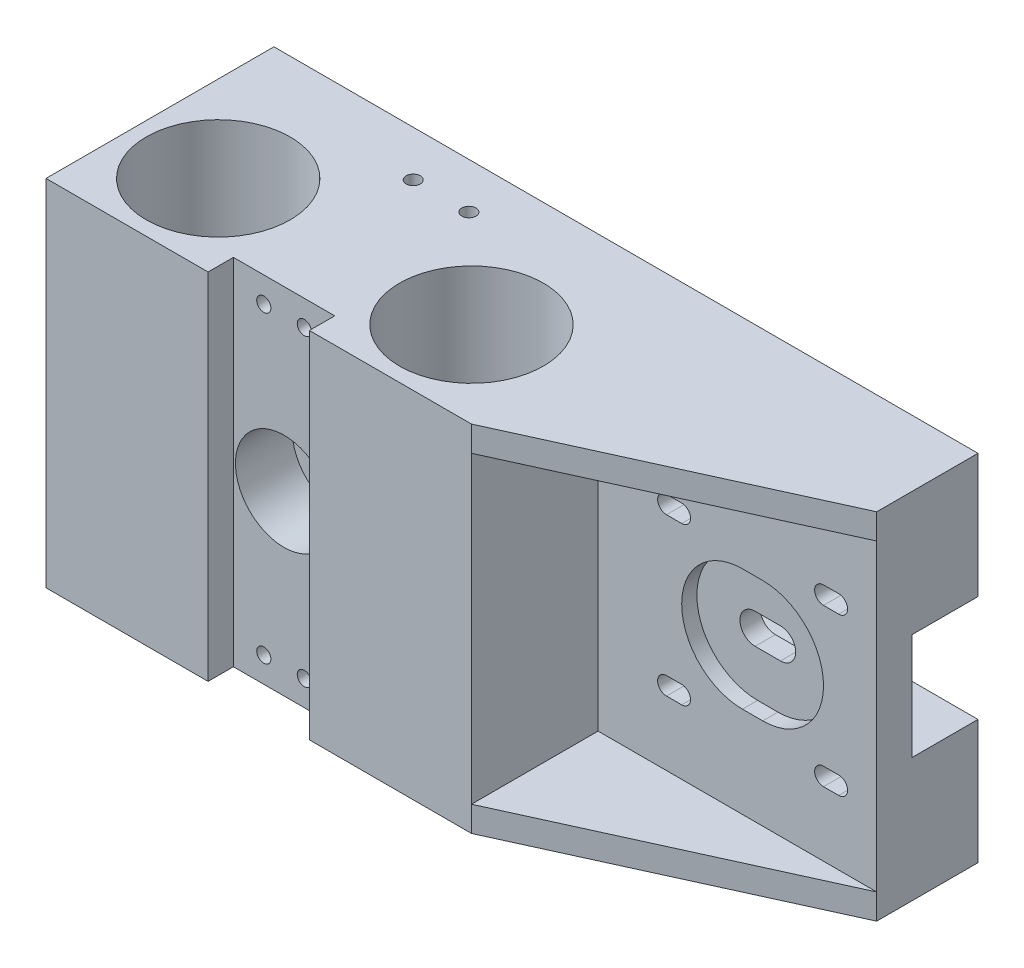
SolidWorks part; units mm, degrees
ref_plane "Спереди" through (0, 0, 0) normal (0, 0, 1) x (1, 0, 0)
ref_plane "Сверху" through (0, 0, 0) normal (0, 1, 0) x (1, 0, 0)
ref_plane "Справа" through (0, 0, 0) normal (1, 0, 0) x (0, 0, -1)
sketch "Эскиз1" plane through (0, 0, 0) normal (0, 1, 0) x (1, 0, 0)
  line L0 (0, 0) -> (0, 80) construction
  line L1 (-36.9154, 0) -> (36.9154, 0) construction
  line L2 (10, 0) -> (10, -5)
  line L3 (10, -5) -> (42, -5)
  line L4 (42, -5) -> (42, 40)
  line L5 (42, 40) -> (0, 40)
  line L6 (10, 0) -> (-10, 0)
  line L7 (-42, -5) -> (-42, 40)
  line L8 (-42, 40) -> (0, 40)
  line L9 (-10, -5) -> (-42, -5)
  line L10 (-10, 0) -> (-10, -5)
  circle A0 centre (-25, 12) radius 14.2
  circle A1 centre (25, 12) radius 14.2
  dimension "D1" = 50
  dimension "D2" = 28.4
  dimension "D3" = 5
  dimension "D4" = 40
  dimension "D5" = 20
  dimension "D6" = 17
  dimension "D7" = 42
extrude "Бобышка-Вытянуть1" add sketch "Эскиз1" along normal blind 70
sketch "Эскиз2" plane through (0, 0, 0) normal (0, 0, 1) x (1, 0, 0)
  line L0 (0, 0) -> (0, 70) construction
  line L1 (10, 70) -> (-10, 70) construction
  line L2 (-10, 35) -> (0, 35) construction
  line L4 (-10, 70) -> (-10, 0) construction
  circle A0 centre (-4, 65) radius 1.4
  circle A1 centre (-4, 5) radius 1.4
  circle A2 centre (4, 5) radius 1.4
  circle A3 centre (4, 65) radius 1.4
  dimension "D1" = 5
  dimension "D2" = 4
  dimension "D3" = 2.8
extrude "Вырез-Вытянуть1" cut sketch "Эскиз2" against normal blind 5
sketch "Эскиз3" plane through (0, 0, 0) normal (0, 0, 1) x (1, 0, 0)
  line L0 (-10, 35) -> (10, 35) construction
  line L1 (-10, 70) -> (-10, 0) construction
  line L2 (10, 70) -> (10, 0) construction
  circle A0 centre (0, 35) radius 9.6
  dimension "D1" = 19.2
extrude "Вырез-Вытянуть2" cut sketch "Эскиз3" against normal blind 11.2
sketch "Эскиз4" plane through (0, 0, -40) normal (0, 0, -1) x (-1, 0, 0)
  line L0 (-42, 35) -> (42, 35) construction
  line L1 (-42, 70) -> (-42, 0) construction
  line L2 (42, 70) -> (42, 0) construction
  circle A0 centre (0, 35) radius 9.6
  dimension "D1" = 19.2
extrude "Вырез-Вытянуть3" cut sketch "Эскиз4" against normal blind 19
sketch "Эскиз5" plane through (42, 0, 0) normal (1, 0, 0) x (0, 0, -1)
  line L0 (-5, 35) -> (40, 35) construction
  line L1 (40, 70) -> (20, 70)
  line L2 (40, 70) -> (40, 0)
  line L3 (40, 0) -> (20, 0)
  line L4 (20, 70) -> (20, 0)
  line L5 (-5, 70) -> (-5, 0) construction
  line L6 (40, 70) -> (40, 0) construction
  line L7 (-5, 70) -> (40, 70) construction
  dimension "D2" = 20
extrude "Бобышка-Вытянуть2" add sketch "Эскиз5" along normal blind 55
sketch "Эскиз6" plane through (0, 0, -40) normal (0, 0, -1) x (-1, 0, 0)
  line L0 (0, 35) -> (-97, 35) construction
  line L1 (-97, 0) -> (-97, 70) construction
  line L2 (-97, 0) -> (-97, 70) construction
  line L3 (-97, 45.5) -> (10, 45.5)
  line L4 (-97, 45.5) -> (-97, 24.5)
  line L5 (-97, 24.5) -> (10, 24.5)
  line L6 (10, 45.5) -> (10, 24.5)
  circle A0 centre (0, 35) radius 9.6 construction
  dimension "D2" = 10
  dimension "D1" = 21
  dimension "D3" = 0
extrude "Вырез-Вытянуть4" cut sketch "Эскиз6" against normal blind 13
sketch "Эскиз7" plane through (0, 70, 0) normal (0, 1, 0) x (1, 0, 0)
  line L0 (42, -5) -> (97, 20)
  line L1 (97, 20) -> (42, 20)
  line L2 (42, 20) -> (42, -5)
extrude "Бобышка-Вытянуть3" add sketch "Эскиз7" against normal blind 5
sketch "Эскиз8" plane through (0, 0, 0) normal (0, -1, 0) x (1, 0, 0)
  line L0 (42, 5) -> (97, -20)
  line L1 (97, -20) -> (42, -20)
  line L2 (42, -20) -> (42, 5)
extrude "Бобышка-Вытянуть4" add sketch "Эскиз8" against normal blind 5
sketch "Эскиз9" plane through (0, 0, -40) normal (0, 0, -1) x (-1, 0, 0)
  line L0 (-89.5, 50.5) -> (-86.5, 50.5) construction
  line L1 (-89.5, 52.25) -> (-86.5, 52.25)
  line L2 (-89.5, 48.75) -> (-86.5, 48.75)
  line L3 (-58.5, 50.5) -> (-55.5, 50.5) construction
  line L4 (-58.5, 52.25) -> (-55.5, 52.25)
  line L5 (-58.5, 48.75) -> (-55.5, 48.75)
  line L6 (-89.5, 19.5) -> (-86.5, 19.5) construction
  line L7 (-89.5, 21.25) -> (-86.5, 21.25)
  line L8 (-89.5, 17.75) -> (-86.5, 17.75)
  line L9 (-58.5, 19.5) -> (-55.5, 19.5) construction
  line L10 (-58.5, 21.25) -> (-55.5, 21.25)
  line L11 (-58.5, 17.75) -> (-55.5, 17.75)
  arc A0 (-58.5, 21.25) -> (-58.5, 17.75) centre (-58.5, 19.5) ccw
  circle A1 centre (-57, 19.5) radius 2 construction
  circle A2 centre (-88, 19.5) radius 2 construction
  circle A3 centre (-88, 50.5) radius 2 construction
  circle A4 centre (-57, 50.5) radius 2 construction
  circle A6 centre (-57, 19.5) radius 2 construction
  circle A7 centre (-88, 19.5) radius 2 construction
  circle A8 centre (-88, 50.5) radius 2 construction
  circle A9 centre (-57, 50.5) radius 2 construction
  arc A14 (-89.5, 52.25) -> (-89.5, 48.75) centre (-89.5, 50.5) ccw
  arc A15 (-86.5, 48.75) -> (-86.5, 52.25) centre (-86.5, 50.5) ccw
  arc A16 (-58.5, 52.25) -> (-58.5, 48.75) centre (-58.5, 50.5) ccw
  arc A17 (-55.5, 48.75) -> (-55.5, 52.25) centre (-55.5, 50.5) ccw
  arc A18 (-89.5, 21.25) -> (-89.5, 17.75) centre (-89.5, 19.5) ccw
  arc A19 (-86.5, 17.75) -> (-86.5, 21.25) centre (-86.5, 19.5) ccw
  arc A20 (-55.5, 17.75) -> (-55.5, 21.25) centre (-55.5, 19.5) ccw
  point P10 (-88, 50.5)
  point P19 (-57, 50.5)
  point P26 (-88, 19.5)
  point P33 (-57, 19.5)
  dimension "D1" = 3.5
  dimension "D2" = 3
  dimension "D3" = 3.5
  dimension "D4" = 3
  dimension "D5" = 3.5
  dimension "D6" = 3
  dimension "D7" = 3
  dimension "D8" = 3.5
extrude "Вырез-Вытянуть5" cut sketch "Эскиз9" against normal blind 68
sketch "Эскиз10" plane through (0, 0, -21) normal (0, 0, -1) x (-1, 0, 0)
  circle A0 centre (0, 35) radius 3.25
  dimension "D1" = 6.5
extrude "Вырез-Вытянуть6" cut sketch "Эскиз10" against normal blind 68
sketch "Эскиз11" plane through (0, 0, -20) normal (0, 0, 1) x (1, 0, 0)
  line L0 (70.5, 35) -> (74.5, 35) construction
  line L1 (70.5, 47) -> (74.5, 47)
  line L2 (70.5, 23) -> (74.5, 23)
  circle A0 centre (72.5, 35) radius 11 construction
  circle A1 centre (72.5, 35) radius 11 construction
  arc A3 (70.5, 47) -> (70.5, 23) centre (70.5, 35) ccw
  arc A4 (74.5, 23) -> (74.5, 47) centre (74.5, 35) ccw
  point P5 (72.5, 35)
  dimension "D1" = 24
  dimension "D2" = 4
extrude "Вырез-Вытянуть7" cut sketch "Эскиз11" against normal blind 3
sketch "Эскиз12" plane through (0, 0, -23) normal (0, 0, 1) x (1, 0, 0)
  line L0 (72.5, 47) -> (72.5, 23) construction
  line L1 (74.5, 47) -> (70.5, 47) construction
  line L2 (70.5, 23) -> (74.5, 23) construction
  line L3 (70, 35) -> (75, 35) construction
  line L4 (70, 38) -> (75, 38)
  line L5 (70, 32) -> (75, 32)
  arc A1 (70, 38) -> (70, 32) centre (70, 35) ccw
  arc A2 (75, 32) -> (75, 38) centre (75, 35) ccw
  point P9 (72.5, 35)
  dimension "D1" = 6
  dimension "D2" = 5
extrude "Вырез-Вытянуть8" cut sketch "Эскиз12" against normal through all
sketch "Эскиз14" plane through (0, 0, -40) normal (0, 0, -1) x (-1, 0, 0)
  line L0 (-91.25, 50.5) -> (-84.75, 50.5) construction
  line L1 (-88, 52.25) -> (-88, 48.75) construction
  line L2 (-86.5, 52.25) -> (-89.5, 52.25) construction
  line L3 (-89.5, 48.75) -> (-86.5, 48.75) construction
  line L4 (-60.25, 50.5) -> (-53.75, 50.5) construction
  line L5 (-57, 52.25) -> (-57, 48.75) construction
  line L6 (-55.5, 52.25) -> (-58.5, 52.25) construction
  line L7 (-58.5, 48.75) -> (-55.5, 48.75) construction
  line L8 (-88, 21.25) -> (-88, 17.75) construction
  line L9 (-86.5, 21.25) -> (-89.5, 21.25) construction
  line L10 (-89.5, 17.75) -> (-86.5, 17.75) construction
  line L11 (-91.25, 19.5) -> (-84.75, 19.5) construction
  line L12 (-57, 21.25) -> (-57, 17.75) construction
  line L13 (-55.5, 21.25) -> (-58.5, 21.25) construction
  line L14 (-58.5, 17.75) -> (-55.5, 17.75) construction
  line L15 (-60.25, 19.5) -> (-53.75, 19.5) construction
  line L16 (-90, 50.5) -> (-86, 50.5) construction
  line L17 (-90, 53.5) -> (-86, 53.5)
  line L18 (-90, 47.5) -> (-86, 47.5)
  line L19 (-59, 50.5) -> (-55, 50.5) construction
  line L20 (-59, 53.5) -> (-55, 53.5)
  line L21 (-59, 47.5) -> (-55, 47.5)
  line L22 (-90, 19.5) -> (-86, 19.5) construction
  line L23 (-90, 22.5) -> (-86, 22.5)
  line L24 (-90, 16.5) -> (-86, 16.5)
  line L25 (-59, 19.5) -> (-55, 19.5) construction
  line L26 (-59, 22.5) -> (-55, 22.5)
  line L27 (-59, 16.5) -> (-55, 16.5)
  arc A0 (-89.5, 52.25) -> (-89.5, 48.75) centre (-89.5, 50.5) ccw construction
  arc A1 (-86.5, 48.75) -> (-86.5, 52.25) centre (-86.5, 50.5) ccw construction
  arc A2 (-58.5, 52.25) -> (-58.5, 48.75) centre (-58.5, 50.5) ccw construction
  arc A3 (-55.5, 48.75) -> (-55.5, 52.25) centre (-55.5, 50.5) ccw construction
  arc A4 (-89.5, 21.25) -> (-89.5, 17.75) centre (-89.5, 19.5) ccw construction
  arc A5 (-86.5, 17.75) -> (-86.5, 21.25) centre (-86.5, 19.5) ccw construction
  arc A6 (-58.5, 21.25) -> (-58.5, 17.75) centre (-58.5, 19.5) ccw construction
  arc A7 (-55.5, 17.75) -> (-55.5, 21.25) centre (-55.5, 19.5) ccw construction
  arc A8 (-90, 53.5) -> (-90, 47.5) centre (-90, 50.5) ccw
  arc A9 (-86, 47.5) -> (-86, 53.5) centre (-86, 50.5) ccw
  arc A10 (-59, 53.5) -> (-59, 47.5) centre (-59, 50.5) ccw
  arc A11 (-55, 47.5) -> (-55, 53.5) centre (-55, 50.5) ccw
  arc A12 (-90, 22.5) -> (-90, 16.5) centre (-90, 19.5) ccw
  arc A13 (-86, 16.5) -> (-86, 22.5) centre (-86, 19.5) ccw
  arc A14 (-59, 22.5) -> (-59, 16.5) centre (-59, 19.5) ccw
  arc A15 (-55, 16.5) -> (-55, 22.5) centre (-55, 19.5) ccw
  point P58 (-88, 50.5)
  point P63 (-57, 50.5)
  point P72 (-88, 19.5)
  point P77 (-57, 19.5)
  dimension "D1" = 6
  dimension "D2" = 6
  dimension "D3" = 6
  dimension "D4" = 6
  dimension "D5" = 4
  dimension "D6" = 4
  dimension "D7" = 4
  dimension "D8" = 4
extrude "Вырез-Вытянуть10" cut sketch "Эскиз14" against normal blind 5
sketch "Эскиз15" plane through (0, 0, -40) normal (0, 0, -1) x (-1, 0, 0)
  line L0 (42, 35) -> (-97, 35) construction
  line L1 (42, 70) -> (42, 0) construction
  line L2 (-97, 45.5) -> (-97, 24.5) construction
  line L3 (-97, 70) -> (42, 70) construction
  line L4 (-92, 65) -> (37, 65) construction
  line L5 (-92, 65) -> (-92, 5) construction
  line L6 (-92, 5) -> (37, 5) construction
  line L7 (37, 65) -> (37, 5) construction
  line L8 (-97, 45.5) -> (-97, 70) construction
  circle A0 centre (-92, 65) radius 1.4
  circle A1 centre (37, 65) radius 1.4
  circle A2 centre (37, 5) radius 1.4
  circle A3 centre (-92, 5) radius 1.4
  circle A4 centre (-27.5, 65) radius 1.4
  circle A6 centre (-27.5, 5) radius 1.4
  dimension "D4" = 2.8
  dimension "D1" = 5
  dimension "D2" = 5
  dimension "D3" = 5
extrude "Вырез-Вытянуть11" cut sketch "Эскиз15" against normal blind 5
sketch "Эскиз17" plane through (0, 70, 0) normal (0, 1, 0) x (1, 0, 0)
  circle A0 centre (-5.5, 31) radius 1.75 construction
  circle A1 centre (5.5, 31) radius 1.75 construction
  circle A2 centre (-5.5, 31) radius 1.75 construction
  circle A3 centre (5.5, 31) radius 1.75 construction
  circle A4 centre (-5.5, 31) radius 1.4
  circle A5 centre (5.5, 31) radius 1.4
  dimension "D1" = 2.8
extrude "Вырез-Вытянуть12" cut sketch "Эскиз17" against normal blind 5
ref_plane "Плоскость1" through (0, 35, 0) normal (0, -1, 0) x (-1, 0, 0)
mirror "Зеркальное отражение1" about plane through (0, 35, 0) normal (0, -1, 0) of "Вырез-Вытянуть12"
